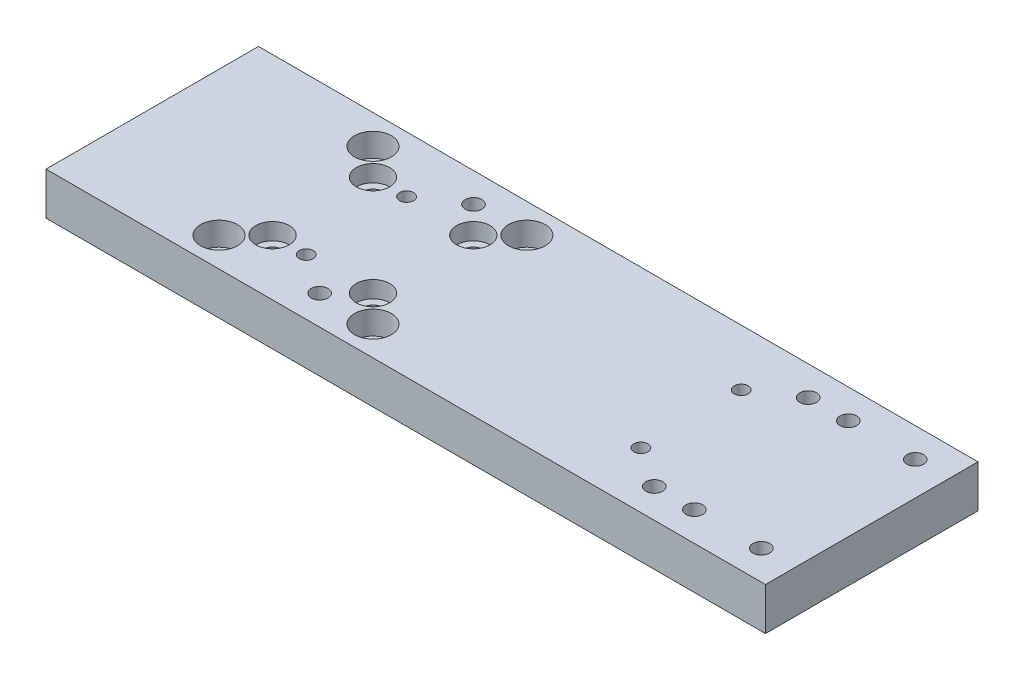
SolidWorks part; units mm, degrees
ref_plane "Front Plane" through (0, 0, 0) normal (0, 0, 1) x (1, 0, 0)
ref_plane "Top Plane" through (0, 0, 0) normal (0, 1, 0) x (1, 0, 0)
ref_plane "Right Plane" through (0, 0, 0) normal (1, 0, 0) x (0, 0, -1)
sketch "Sketch1" plane through (0, 0, 0) normal (0, 1, 0) x (1, 0, 0)
  line L1 (0, 0) -> (220, 0)
  line L2 (0, 0) -> (0, 63.5)
  line L3 (0, 63.5) -> (220, 63.5)
  line L4 (220, 0) -> (220, 63.5)
  dimension "D1" = 63.5
  dimension "D2" = 220
extrude "Extrude1" add sketch "Sketch1" along normal blind 12.7
sketch "Sketch2" plane through (0, 12.7, 0) normal (0, 1, 0) x (1, 0, 0)
  line L0 (65.95, 76.2) -> (65.95, 0) construction
  line L1 (23.45, 6.75) -> (73.45, 6.75) construction
  line L3 (0, 31.75) -> (220, 31.75) construction
  line L4 (0, 63.5) -> (0, 0) construction
  line L5 (220, 0) -> (220, 63.5) construction
  point P12 (23.45, 56.75)
  point P13 (50.95, 46.75)
  point P14 (42.95, 54.75)
  point P16 (73.45, 56.75)
  point P17 (73.45, 6.75)
  point P18 (23.45, 6.75)
  point P19 (80.95, 46.75)
  point P20 (80.95, 16.75)
  point P21 (50.95, 16.75)
  point P22 (88.95, 54.75)
  point P23 (88.95, 8.75)
  point P24 (42.95, 8.75)
  dimension "D1" = 50
  dimension "D2" = 50
  dimension "D3" = 46
  dimension "D4" = 46
  dimension "D5" = 30
  dimension "D6" = 30
  dimension "D11" = 65.95
  dimension "D12" = 7.5
hole_wizard "M3x0.5 Tapped Hole3" positions "3DSketch24" profile "Sketch37" tap size "M3x0.5" standard "Ansi Metric"
sketch3d "3DSketch24"
  point P0 (145, 3.5, 0)
  point P3 (105, 3.5, 0)
  point P7 (185, 3.5, 0)
  point P10 (65, 3.5, 0)
sketch "Sketch37" plane through (145, 3.5, 0) normal (1, 0, 0) x (0, -1, 0)
  line L0 (0, 0) -> (0, 7.2511)
  line L1 (0, 7.2511) -> (1.25, 6.5)
  line L2 (1.25, 6.5) -> (1.25, 0)
  line L5 (1.25, 0) -> (0, 0)
  line L10 (0, 7.2511) -> (-1.25, 6.5) construction
  line L11 (0, -6.35) -> (0, 107.95) construction
  dimension "Tap Drill Dia." = 2.5
  dimension "Tap Drill Depth" = 6.5
  dimension "Drill Angle" = 118
sketch "Sketch38" plane through (0, 12.7, 0) normal (0, 1, 0) x (1, 0, 0)
  line L0 (0, 31.75) -> (220, 31.75) construction
  line L1 (0, 63.5) -> (0, 0) construction
  line L2 (220, 0) -> (220, 63.5) construction
sketch3d "3DSketch25"
  line L0 (0, 12.7, -31.75) -> (220, 12.7, -31.75) construction
ref_plane "Plane1" through (0, 0, -31.75) normal (0, 0, 1) x (1, 0, 0)
mirror "Mirror1" [suppressed] about plane through (0, 0, -31.75) normal (0, 0, 1)
sketch "Sketch40" plane through (0, 12.7, 0) normal (0, 1, 0) x (1, 0, 0)
  line L0 (73.89, 5.6) -> (73.89, 70.6) construction
  line L1 (110, 0) -> (110, 63.5) construction
  line L2 (0, 0) -> (220, 0) construction
  line L3 (220, 63.5) -> (0, 63.5) construction
  point P4 (73.89, 13.1)
  point P5 (73.89, 20.6)
  point P12 (146.11, 13.1)
  point P13 (146.11, 20.6)
  dimension "D1" = 7.5
  dimension "D2" = 7.5
  dimension "D3" = 36.11
hole_wizard "M3x0.5 Tapped Hole5" positions "3DSketch26" profile "Sketch41" tap size "M3x0.5" standard "Ansi Metric"
sketch3d "3DSketch26"
  point P0 (88.89, 12.7, -20.6)
  point P3 (88.89, 12.7, -13.1)
  point P7 (161.11, 12.7, -20.6)
  point P10 (161.11, 12.7, -13.1)
sketch "Sketch41" plane through (88.89, 12.7, -20.6) normal (1, 0, 0) x (0, 0, 1)
  line L0 (0, 0) -> (0, 12.7)
  line L1 (0, 12.7) -> (1.25, 12.7)
  line L2 (1.25, 12.7) -> (1.25, 0)
  line L5 (1.25, 0) -> (0, 0)
  line L11 (0, -6.35) -> (0, 107.95) construction
  dimension "Thru Tap Drill Dia." = 2.5
  dimension "Thru Tap Drill Depth" = 12.7
sketch "Sketch42" plane through (0, 12.7, 0) normal (0, 1, 0) x (1, 0, 0)
  line L0 (-41.0417, 31.75) -> (41.0417, 31.75) construction
  line L1 (61, 46.75) -> (161, 46.75) construction
  line L2 (61, 46.75) -> (61, 16.75) construction
  line L3 (61, 16.75) -> (161, 16.75) construction
  line L4 (161, 46.75) -> (161, 16.75) construction
  line L5 (0, 63.5) -> (0, 0) construction
  dimension "D1" = 30
  dimension "D2" = 15
  dimension "D3" = 100
  dimension "D4" = 61
hole_wizard "M5x0.8 Tapped Hole1" positions "3DSketch27" profile "Sketch43" tap size "M5x0.8" standard "Ansi Metric"
sketch3d "3DSketch27"
  point P0 (161, 12.7, -16.75)
  point P3 (161, 12.7, -46.75)
  point P6 (61, 12.7, -46.75)
  point P9 (61, 12.7, -16.75)
sketch "Sketch43" plane through (161, 12.7, -16.75) normal (1, 0, 0) x (0, 0, 1)
  line L0 (0, 0) -> (0, 12.7)
  line L1 (0, 12.7) -> (2.1, 12.7)
  line L2 (2.1, 12.7) -> (2.1, 0)
  line L5 (2.1, 0) -> (0, 0)
  line L11 (0, -6.35) -> (0, 107.95) construction
  dimension "Thru Tap Drill Dia." = 4.2
  dimension "Thru Tap Drill Depth" = 12.7
sketch "Sketch47" plane through (0, 12.7, 0) normal (0, 1, 0) x (-1, 0, 0)
  line L0 (-60, -61.8685) -> (-60, -16.75)
  line L1 (0, -31.75) -> (-108.0623, -31.75)
  line L2 (0, -63.5) -> (0, 0) construction
  line L3 (-75, -16.75) -> (-45, -16.75)
sketch3d "3DSketch29" plane through (0, 0, 0) normal (0, 0, 1) x (1, 0, 0)
  dimension "D1" = 60
ref_plane "Plane2" through (60, 0, 0) normal (-1, 0, 0) x (0, 0, 1)
sketch3d "3DSketch30"
  line L0 (0, 12.7, -31.75) -> (108.0623, 12.7, -31.75) construction
ref_plane "Plane3" through (0, 0, -31.75) normal (0, 0, 1) x (1, 0, 0)
hole_wizard "CBORE for M5 SHCS1" positions "Sketch53" profile "Sketch52" counterbore size "M5" standard "ANSI Metric"
sketch "Sketch53" plane through (0, 12.7, 0) normal (0, 1, 0) x (-1, 0, 0)
  point P0 (-80.95, -46.75)
  point P3 (-80.95, -16.75)
  point P6 (-50.95, -16.75)
  point P9 (-50.95, -46.75)
sketch "Sketch52" plane through (80.95, 12.7, -46.75) normal (1, 0, 0) x (0, 0, 1)
  line L0 (0, 0) -> (0, 12.7)
  line L1 (0, 12.7) -> (2.75, 12.7)
  line L3 (2.75, 12.7) -> (2.75, 5)
  line L4 (2.75, 5) -> (5, 5)
  line L5 (5, 5) -> (5, 0)
  line L7 (5, 0) -> (0, 0)
  line L11 (0, -6.35) -> (0, 107.95) construction
  dimension "Thru Hole Dia." = 5.5
  dimension "Thru Hole Depth" = 12.7
  dimension "C'Bore Dia." = 10
  dimension "C'Bore Depth" = 5
hole_wizard "CBORE for M6 SHCS2" positions "Sketch55" profile "Sketch54" counterbore size "M6" standard "ANSI Metric"
sketch "Sketch55" plane through (0, 12.7, 0) normal (0, 1, 0) x (1, 0, 0)
  point P0 (88.95, 8.75)
  point P3 (88.95, 54.75)
  point P6 (42.95, 54.75)
  point P9 (42.95, 8.75)
sketch "Sketch54" plane through (88.95, 12.7, -8.75) normal (1, 0, 0) x (0, 0, 1)
  line L0 (0, 0) -> (0, 12.7)
  line L1 (0, 12.7) -> (3.3, 12.7)
  line L3 (3.3, 12.7) -> (3.3, 7)
  line L4 (3.3, 7) -> (5.5, 7)
  line L5 (5.5, 7) -> (5.5, 0)
  line L7 (5.5, 0) -> (0, 0)
  line L11 (0, -6.35) -> (0, 107.95) construction
  dimension "Thru Hole Dia." = 6.6
  dimension "Thru Hole Depth" = 12.7
  dimension "C'Bore Dia." = 11
  dimension "C'Bore Depth" = 7
hole_wizard "M6x1.0 Tapped Hole1" positions "Sketch57" profile "Sketch56" tap size "M6x1.0" standard "ANSI Metric"
sketch "Sketch57" plane through (0, 12.7, 0) normal (0, 1, 0) x (1, 0, 0)
  line L1 (173, 54.75) -> (73, 54.75) construction
  line L2 (173, 54.75) -> (173, 8.75) construction
  line L3 (173, 8.75) -> (73, 8.75) construction
  line L4 (73, 54.75) -> (73, 8.75) construction
  line L5 (73, 31.75) -> (0, 31.75) construction
  line L6 (0, 63.5) -> (0, 0) construction
  line L7 (205, 54.75) -> (205, 8.75) construction
  line L9 (205, 54.75) -> (173, 54.75) construction
  line L11 (205, 8.75) -> (173, 8.75) construction
  line L13 (220, 0) -> (220, 63.5) construction
  line L14 (185, 54.75) -> (185, 8.75) construction
  point P0 (173, 54.75)
  point P2 (173, 8.75)
  point P6 (73, 8.75)
  point P60 (73, 54.75)
  point P61 (205, 8.75)
  point P63 (205, 54.75)
  point P82 (185, 54.75)
  point P84 (185, 8.75)
  dimension "D1" = 46
  dimension "D2" = 100
  dimension "D3" = 73
  dimension "D4" = 15
  dimension "D5" = 20
sketch "Sketch56" plane through (173, 12.7, -54.75) normal (1, 0, 0) x (0, 0, 1)
  line L0 (0, 0) -> (0, 12.7)
  line L1 (0, 12.7) -> (2.5, 12.7)
  line L2 (2.5, 12.7) -> (2.5, 0)
  line L5 (2.5, 0) -> (0, 0)
  line L11 (0, -6.35) -> (0, 107.95) construction
  dimension "Thru Tap Drill Dia." = 5
  dimension "Thru Tap Drill Depth" = 12.7
other "Move Face1" parameters "D1"=5
